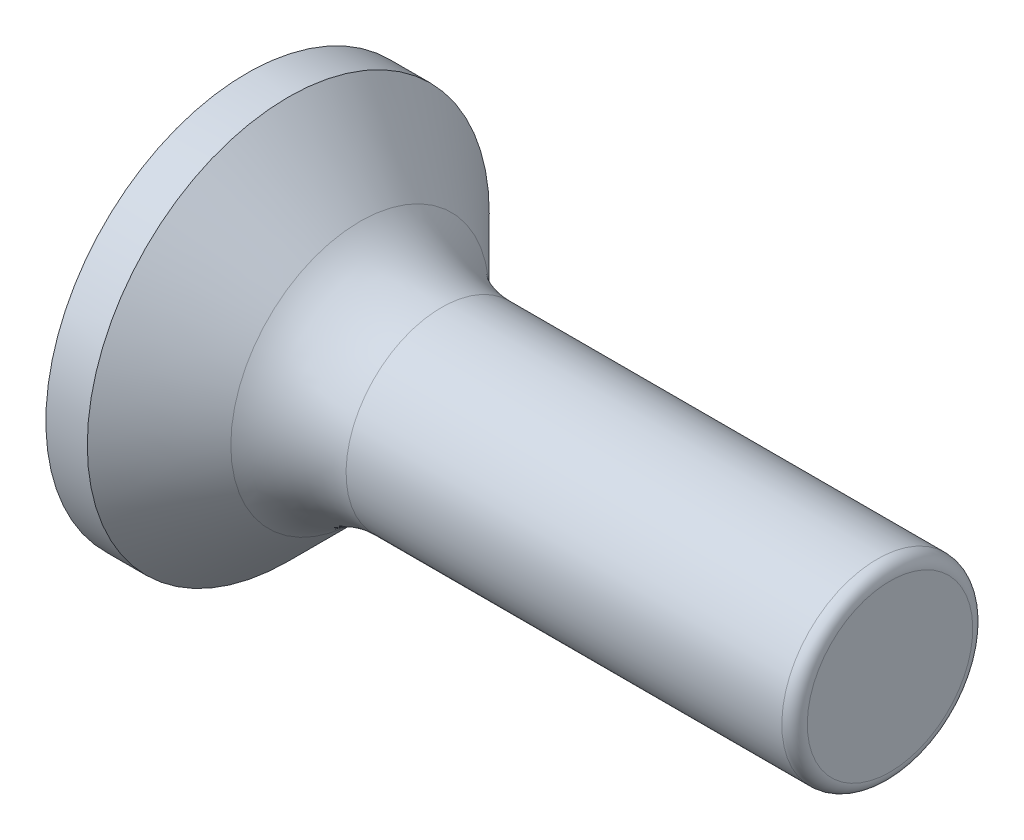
SolidWorks part; units mm, degrees
ref_plane "Front" through (0, 0, 0) normal (0, 0, 1) x (1, 0, 0)
ref_plane "Top" through (0, 0, 0) normal (0, 1, 0) x (1, 0, 0)
ref_plane "Right" through (0, 0, 0) normal (1, 0, 0) x (0, 0, -1)
sketch "Sketch1" plane through (0, 0, 0) normal (0, 0, 1) x (1, 0, 0)
  line L0 (-18.0939, 0) -> (12.9305, 0) construction
  line L1 (34.3, 0) -> (34.3, 4.75)
  line L2 (34.3, 4.75) -> (11.9851, 4.75)
  line L4 (4.36, 10) -> (2.3, 10)
  line L5 (34.3, 0) -> (0, 0)
  line L6 (7.9305, 6.4295) -> (4.36, 10)
  arc A0 (2.3, 10) -> (0, 0) centre (22.8891, 0) ccw
  arc A1 (7.9305, 6.4295) -> (11.9851, 4.75) centre (11.9851, 10.4841) ccw
  dimension "D2" = 45
  dimension "r" = 5.7341
  dimension "st" = 9.5
  dimension "k" = 5.6305
  dimension "l" = 32
  dimension "dk" = 20
  dimension "f" = 2.3
  dimension "a" = 5
revolve "Base" add sketch "Sketch1" angle 360 about L0
ref_plane "Plane1" through (0, 0, 0) normal (1, 0, 0) x (0, 0, -1)
sketch "Sketch2" plane through (0, 0, 0) normal (1, 0, 0) x (0, 0, -1)
  line L0 (6.5369, 0) -> (-7.0008, 0) construction
  line L1 (0, 6.811) -> (0, -6.4314) construction
  line L2 (-1.01, 5.05) -> (1.01, 5.05)
  line L3 (1.01, 5.05) -> (1.01, 1.01)
  line L4 (1.01, 1.01) -> (5.05, 1.01)
  line L5 (5.05, 1.01) -> (5.05, -1.01)
  line L6 (1.01, -1.01) -> (5.05, -1.01)
  line L7 (1.01, -5.05) -> (1.01, -1.01)
  line L8 (-1.01, -5.05) -> (1.01, -5.05)
  line L9 (-1.01, -5.05) -> (-1.01, -1.01)
  line L10 (-1.01, -1.01) -> (-5.05, -1.01)
  line L11 (-5.05, 1.01) -> (-5.05, -1.01)
  line L12 (-1.01, 1.01) -> (-5.05, 1.01)
  line L13 (-1.01, 5.05) -> (-1.01, 1.01)
  point P5 (-5.05, 0)
  point P11 (5.05, 0)
  point P15 (0, -5.05)
  point P20 (0, 5.05)
  dimension "m" = 10.1
  dimension "D2" = 10.1
  dimension "D3" = 2.02
  dimension "D4" = 2.02
extrude "Cut-Extrude1" cut sketch "Sketch2" along normal blind 2.8153
draft "Draft1" type of draft neutral plane draft angle 45 neutral plane "Plane1" faces to draft 4 parameters "D1"=45
fillet "Fillet2" radius 0.6333 1 edges at (34.3, -4.75, 0)
sketch "Sketch3" plane through (0, 0, 0) normal (0, 0, 1) x (1, 0, 0)
  line L0 (12.4555, 5.7) -> (13.4055, 5.7)
  line L1 (13.4055, 5.7) -> (13.4055, 4.75)
  line L2 (13.4055, 4.75) -> (12.9305, 3.9273)
  line L3 (12.9305, 3.9273) -> (12.4555, 4.75)
  line L4 (12.4555, 4.75) -> (12.4555, 5.7)
  line L5 (0, 0) -> (18.7338, 0) construction
  line L6 (7.9305, -6.4295) -> (7.9305, 6.4295) construction
  dimension "D1" = 9.5
  dimension "D2" = 0.95
  dimension "D3" = 5
revolve "Cut-Revolve10" [suppressed] cut sketch "Sketch3" angle 360 about L5
pattern_linear "LPattern10" [suppressed] count 19 spacing 1.14 along (1, 0, 0)
equation "\"D3@Sketch2\" = \"m@Sketch2\" / 5"
equation "\"D4@Sketch2\" = \"D3@Sketch2\""
equation "\"D2@Sketch2\" = \"m@Sketch2\""
equation "\"D2@ThreadCosmetic1\" = \"st@Sketch1\"* 4 / 5"
equation "\"D1@Plane1\" = \"l@Sketch1\" + \"f@Sketch1\""
equation "\"qs@Cut-Extrude1\" = \"k@Sketch1\" / 2 "
equation "\"D1@Fillet2\" = \"st@Sketch1\" / 15"
equation "\"D1@ThreadCosmetic1\" = \"l@Sketch1\" - \"k@Sketch1\" - \"a@Sketch1\""
equation "\"D1@Sketch3\" = \"st@Sketch1\""
equation "\"D2@Sketch3\" = (  \"st@Sketch1\" - \"D2@ThreadCosmetic1\" )  / 2"
equation "\"D3@Sketch3\" = \"a@Sketch1\""
equation "\"D3@LPattern10\" = \"D2@Sketch3\" * 1.2"
equation "\"D1@LPattern10\" = \"D1@ThreadCosmetic1\" / \"D3@LPattern10\""
